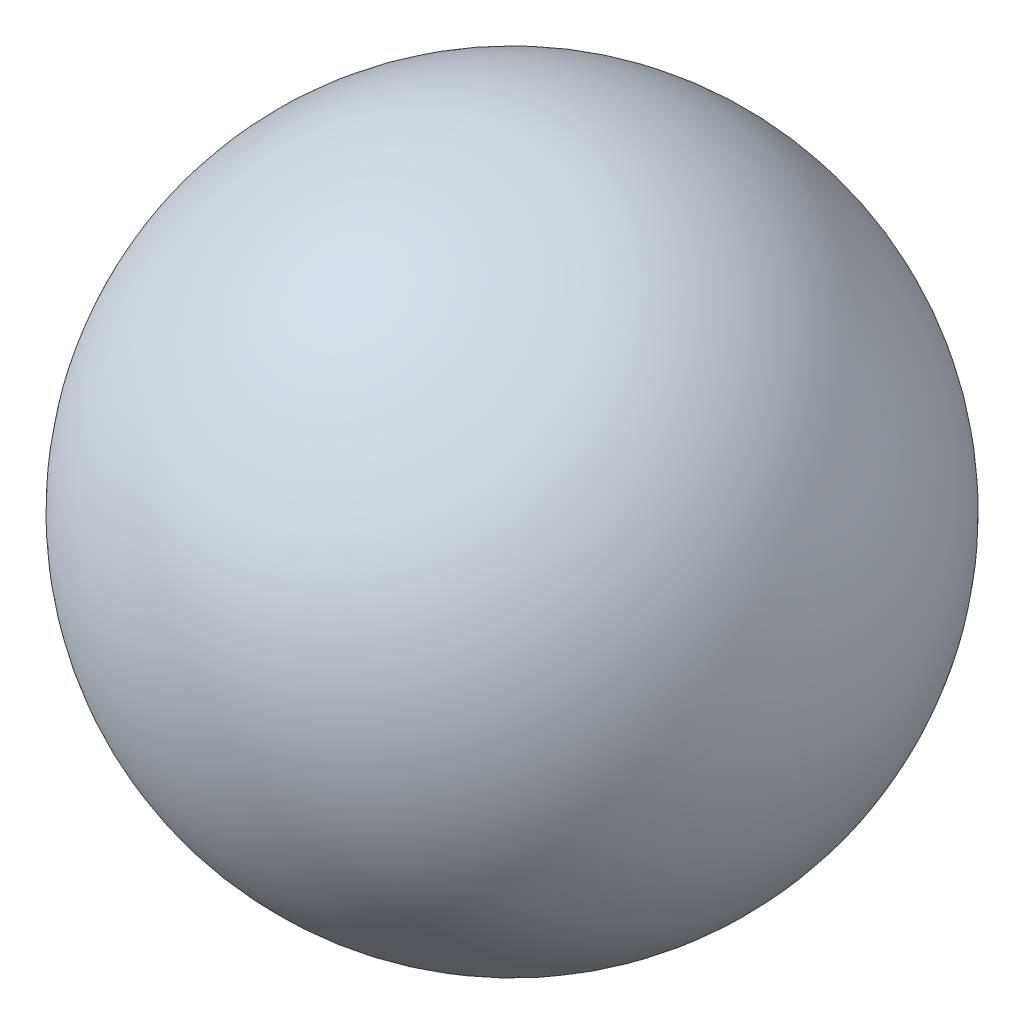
SolidWorks part; units mm, degrees
ref_plane "Front Plane" through (0, 0, 0) normal (0, 0, 1) x (1, 0, 0)
ref_plane "Top Plane" through (0, 0, 0) normal (0, 1, 0) x (1, 0, 0)
ref_plane "Right Plane" through (0, 0, 0) normal (1, 0, 0) x (0, 0, -1)
sketch "Sketch1" plane through (0, 0, 0) normal (0, 1, 0) x (1, 0, 0)
  line L0 (0, 0) -> (0, 2) construction
  line L1 (0, 0) -> (2, 0) construction
  line L2 (0, 0) -> (-2, 0) construction
  line L3 (-2, 0) -> (2, 0)
  arc A0 (2, 0) -> (-2, 0) centre (0, 0) ccw
  dimension "D3" = 2
  dimension "D1" = 2
  dimension "D2" = 2
  dimension "D4" = 2
revolve "Revolve1" add sketch "Sketch1" angle 360 about L3
